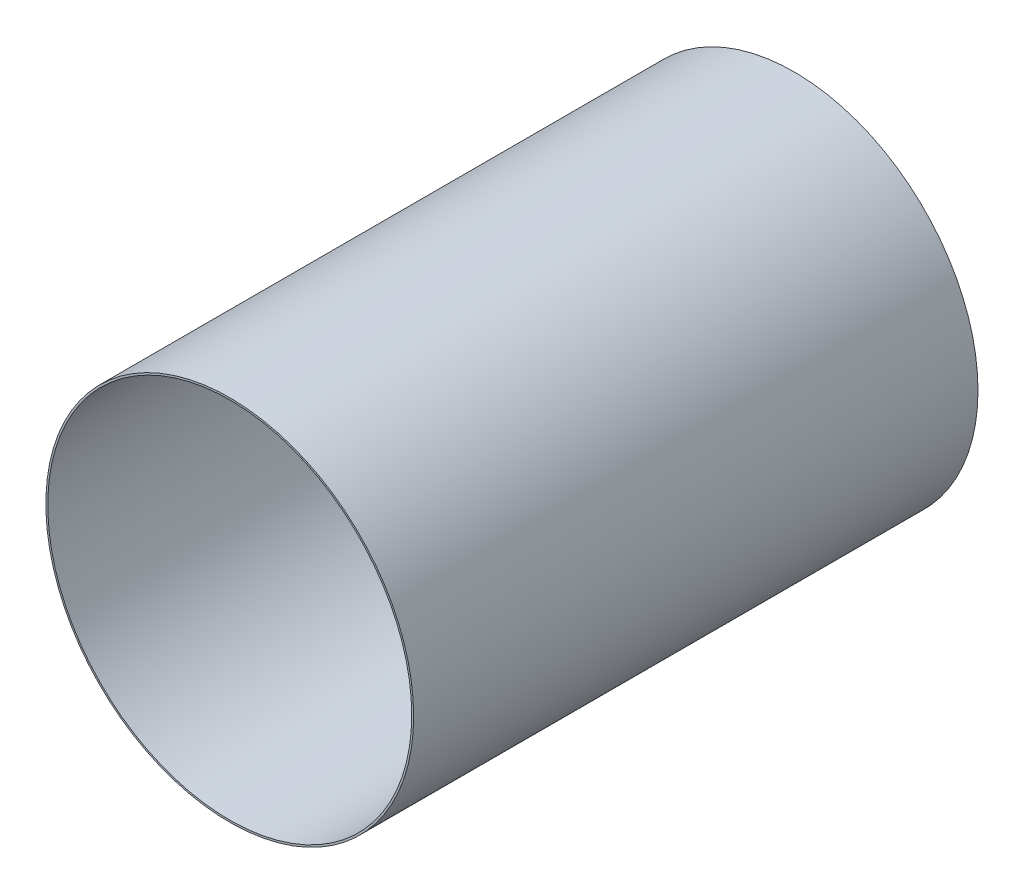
SolidWorks part; units mm, degrees
ref_plane "Ebene vorne" through (0, 0, 0) normal (0, 0, 1) x (1, 0, 0)
ref_plane "Ebene oben" through (0, 0, 0) normal (0, 1, 0) x (1, 0, 0)
ref_plane "Ebene rechts" through (0, 0, 0) normal (1, 0, 0) x (0, 0, -1)
sketch "Skizze1" plane through (0, 0, 0) normal (0, 0, 1) x (1, 0, 0)
  circle A0 centre (0, 0) radius 290
  dimension "D1" = 580
extrude "Linear austragen1" add sketch "Skizze1" along normal blind 890
shell "Wandung1" thickness 3
sketch "Skizze3" plane through (0, 0, 0) normal (0, 0, 1) x (1, 0, 0)
  line L0 (0, 290) -> (0, 0) construction
  line L1 (-133.6063, 195) -> (106.0761, 195) construction
  circle A0 centre (0, 0) radius 290 construction
  dimension "D1" = 195
equation "\"LÄNGE\"=0"
equation "\"BREITE\"=0"
equation "\"HÖHE\"=0"
equation "\"DURCHMESSER\"=0"
equation "\"Stückzahl\"= 1"
